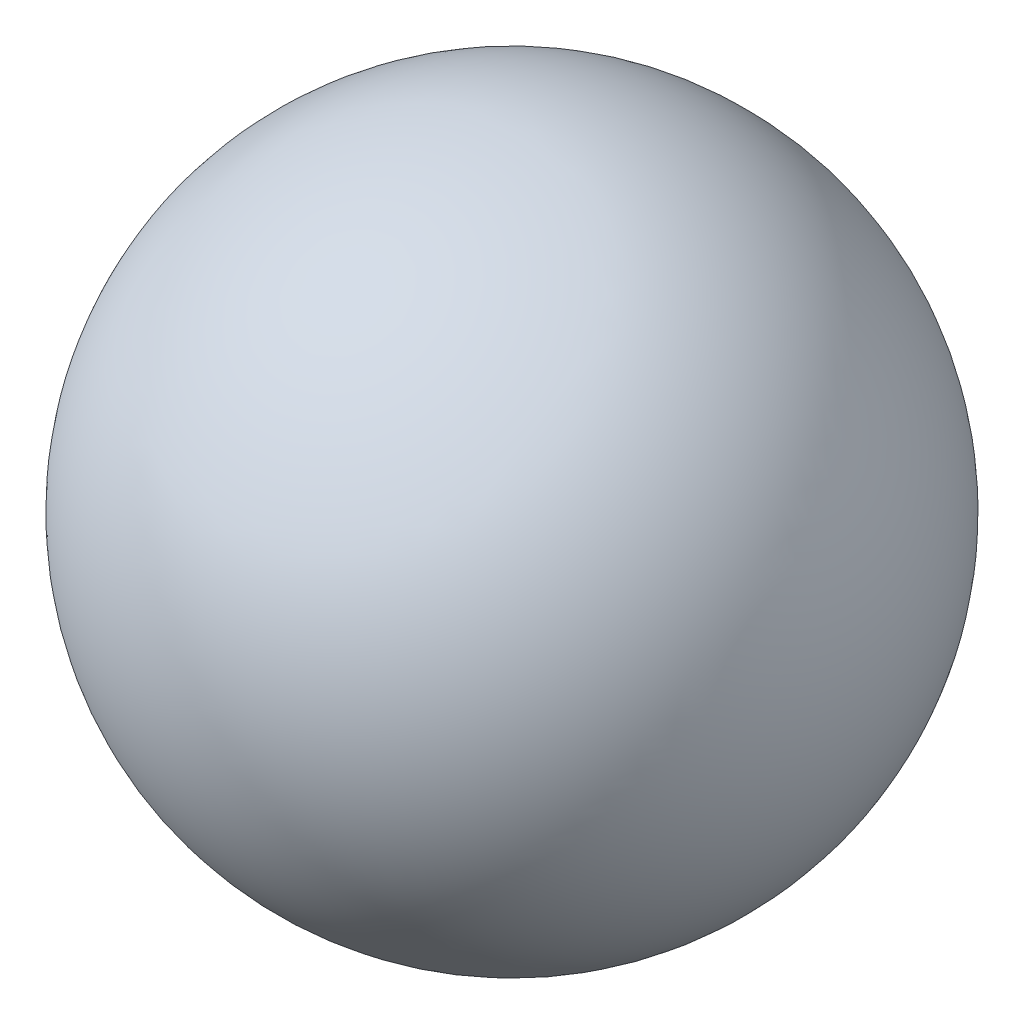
SolidWorks part; units mm, degrees
ref_plane "Face" through (0, 0, 0) normal (0, 0, 1) x (1, 0, 0)
ref_plane "Dessus" through (0, 0, 0) normal (0, 1, 0) x (1, 0, 0)
ref_plane "Droite" through (0, 0, 0) normal (1, 0, 0) x (0, 0, -1)
sketch "Esquisse1" plane through (0, 0, 0) normal (0, 0, 1) x (1, 0, 0)
  line L0 (-6.0857, 0) -> (7.5323, 0) construction
  line L1 (-3.55, 0) -> (3.55, 0)
  arc A0 (3.55, 0) -> (-3.55, 0) centre (0, 0) ccw
  dimension "D1" = 3.55
revolve "Base-Révolution" add sketch "Esquisse1" angle 360 about L0
